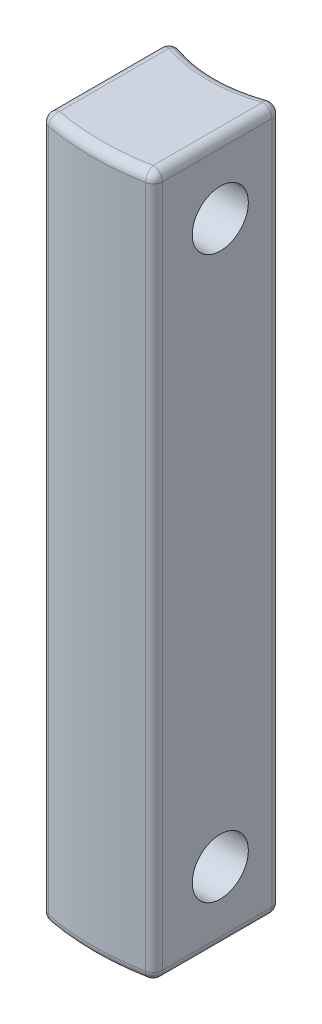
SolidWorks part; units mm, degrees
ref_plane "前视基准面" through (0, 0, 0) normal (0, 0, 1) x (1, 0, 0)
ref_plane "上视基准面" through (0, 0, 0) normal (0, 1, 0) x (1, 0, 0)
ref_plane "右视基准面" through (0, 0, 0) normal (1, 0, 0) x (0, 0, -1)
other "Configuration Table"
sketch "草图1" plane through (0, 0, 0) normal (0, 1, 0) x (1, 0, 0)
  line L0 (-1.7447, 7) -> (-1.7447, -7)
  line L1 (10.2553, 7) -> (10.2553, -7)
  line L2 (4.2553, 37.9729) -> (4.2553, -38.7599) construction
  line L3 (-37.164, 0) -> (37.164, 0) construction
  arc A0 (-1.7447, 7) -> (10.2553, 7) centre (4.2553, 19.6491) ccw
  arc A1 (-1.7447, -7) -> (10.2553, -7) centre (4.2553, 20.3496) ccw
  point P7 (0, 0)
  point P10 (0, 0)
  point P17 (0, 0)
  dimension "D1" = 14
  dimension "D2" = 28
  dimension "D3" = 14
  dimension "D4" = 12
extrude "凸台-拉伸1" add sketch "草图1" along normal mid plane 75
sketch "草图2" plane through (0, 0, 0) normal (1, 0, 0) x (0, 0, -1)
  line L0 (-42.2181, 0) -> (49.7175, 0) construction
  line L1 (0, 37.5) -> (0, -37.5) construction
  line L2 (-7, 37.5) -> (7, 37.5) construction
  line L3 (-7, -37.5) -> (7, -37.5) construction
  circle A0 centre (0, 30) radius 3
  circle A1 centre (0, -30) radius 3
  dimension "D2" = 6
  dimension "D1" = 60
extrude "切除-拉伸1" cut sketch "草图2" against normal through all both and the other way through all
fillet "圆角1" radius 1 12 edges at (-1.7447, 37.5, 0) (10.2553, 37.5, 0) (-1.7447, -37.5, 0) (4.2553, -37.5, 7.6504) (10.2553, 0, 7) (-1.7447, 0, 7) (4.2553, 37.5, 7.6504) (4.2553, -37.5, -5.6491) (10.2553, 0, -7) (-1.7447, 0, -7) (4.2553, 37.5, -5.6491) (10.2553, -37.5, 0)
